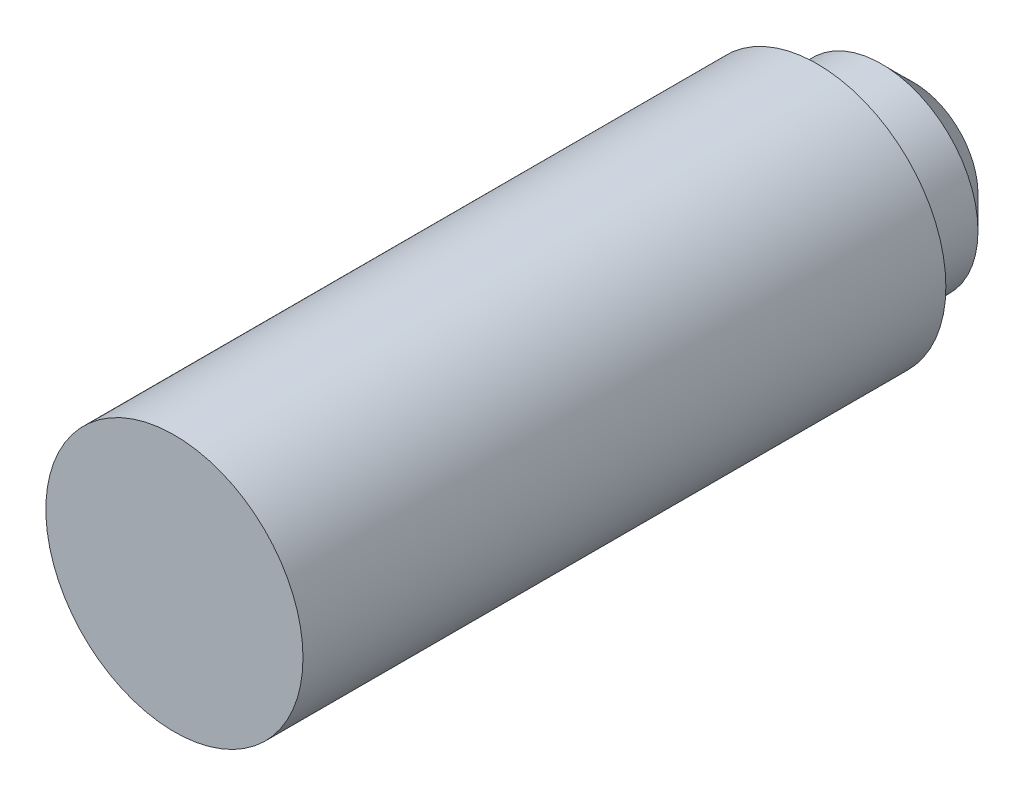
SolidWorks part; units mm, degrees
ref_plane "Plan de face" through (0, 0, 0) normal (0, 0, 1) x (1, 0, 0)
ref_plane "Plan de dessus" through (0, 0, 0) normal (0, 1, 0) x (1, 0, 0)
ref_plane "Plan de droite" through (0, 0, 0) normal (1, 0, 0) x (0, 0, -1)
sketch "Esquisse1" plane through (0, 0, 0) normal (0, 0, 1) x (1, 0, 0)
  circle A0 centre (0, 0) radius 3
  dimension "D1" = 6
extrude "Boss.-Extru.1" add sketch "Esquisse1" along normal blind 3
sketch "Esquisse2" plane through (0, 0, 3) normal (0, 0, 1) x (1, 0, 0)
  circle A0 centre (0, 0) radius 4
  dimension "D1" = 8
extrude "Boss.-Extru.2" add sketch "Esquisse2" along normal blind 20
chamfer "Chanfrein1" distance 1 angle 45 1 edges at (3, 0, 0)
